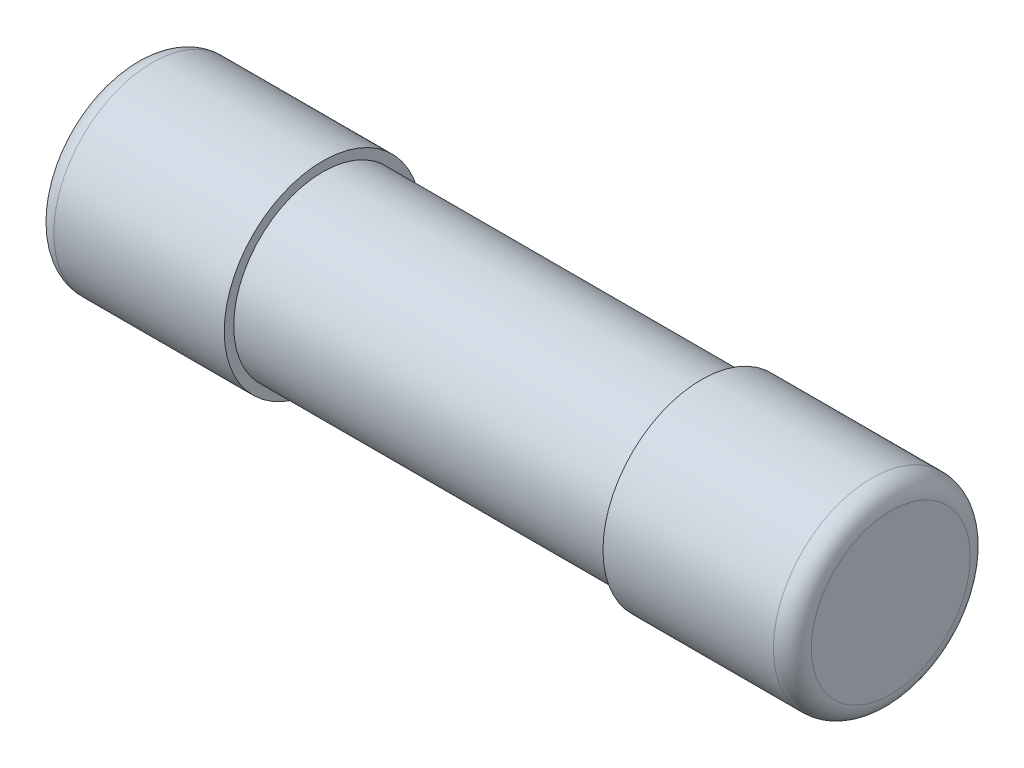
SolidWorks part; units mm, degrees
ref_plane "Front" through (0, 0, 0) normal (0, 0, 1) x (1, 0, 0)
ref_plane "Top" through (0, 0, 0) normal (0, 1, 0) x (1, 0, 0)
ref_plane "Right" through (0, 0, 0) normal (1, 0, 0) x (0, 0, -1)
sketch "Эскиз1" plane through (0, 0, 0) normal (0, 0, 1) x (1, 0, 0)
  line L0 (0, 2.15) -> (0, 0) construction
  line L1 (-9.5, 0) -> (9.5, 0) construction
  line L2 (-9.5, 2.15) -> (-9.5, 2.35)
  line L3 (-9.5, 2.35) -> (9.5, 2.35)
  line L4 (9.5, 2.15) -> (9.5, 2.35)
  line L5 (-9.5, 2.15) -> (9.5, 2.15)
  dimension "D1" = 4.7
  dimension "D2" = 19
  dimension "D3" = 0.2
revolve "Повернуть1" add sketch "Эскиз1" angle 360 about L1
sketch "Эскиз2" plane through (0, 0, 0) normal (0, 0, 1) x (1, 0, 0)
  line L0 (-9.5, 0) -> (0, 0) construction
  line L1 (-9.5, 2.35) -> (-9.5, -2.35) construction
  line L2 (0, 0) -> (0, 2.35) construction
  line L3 (9.5, 2.35) -> (-9.5, 2.35) construction
  line L4 (-9.5, 2.35) -> (-9.5, 0)
  line L5 (-9.5, 2.35) -> (-5, 2.35)
  line L6 (-5, 2.35) -> (-5, 2.6)
  line L7 (-5, 2.6) -> (-9.5, 2.6)
  line L8 (-10, 2.1) -> (-10, 0)
  line L9 (-9.5, 0) -> (-10, 0)
  line L10 (9.5, 0) -> (10, 0)
  line L11 (10, 2.1) -> (10, 0)
  line L12 (5, 2.6) -> (9.5, 2.6)
  line L13 (5, 2.35) -> (5, 2.6)
  line L14 (9.5, 2.35) -> (5, 2.35)
  line L15 (9.5, 2.35) -> (9.5, 0)
  arc A0 (-9.5, 2.6) -> (-10, 2.1) centre (-9.5, 2.1) ccw
  arc A1 (9.5, 2.6) -> (10, 2.1) centre (9.5, 2.1) cw
  point P28 (-10, 2.6)
  dimension "D4" = 0.5
  dimension "D1" = 20
  dimension "D2" = 5.2
  dimension "D3" = 10
revolve "Повернуть4" add sketch "Эскиз2" angle 360 about L0
sketch "Sketch1" plane through (0, 0, 0) normal (1, 0, 0) x (0, 0, -1)
  circle A0 centre (0, 0) radius 0.05
  dimension "D1" = 0.1
extrude "Extrude1" add sketch "Sketch1" along normal up to surface and the other way up to surface
